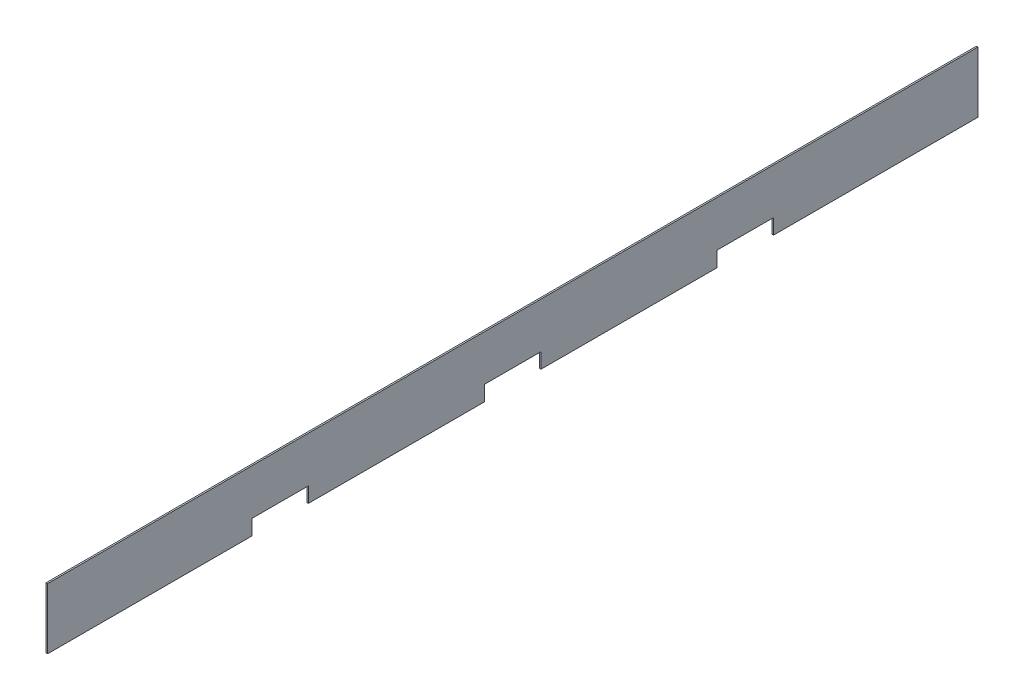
SolidWorks part; units mm, degrees
ref_plane "Vorne" through (0, 0, 0) normal (0, 0, 1) x (1, 0, 0)
ref_plane "Oben" through (0, 0, 0) normal (0, 1, 0) x (1, 0, 0)
ref_plane "Rechts" through (0, 0, 0) normal (1, 0, 0) x (0, 0, -1)
sketch "Skizze1" plane through (0, 0, 0) normal (0, 1, 0) x (1, 0, 0)
  circle A0 centre (0, 0) radius 96.8883
extrude "Linear-Austragen-Dünn1" add sketch "Skizze1" along normal blind 40 thin
sketch "Skizze2" plane through (0, 0, 0) normal (0, 1, 0) x (1, 0, 0)
  line L1 (-18.3447, 95.1358) -> (18.3447, 95.1358)
  line L2 (-18.3447, 95.1358) -> (-18.3447, 97.8883)
  line L3 (-18.3447, 97.8883) -> (18.3447, 97.8883)
  line L4 (18.3447, 95.1358) -> (18.3447, 97.8883)
  circle A0 centre (0, 0) radius 96.8883 construction
  circle A1 centre (0, 0) radius 97.8883 construction
extrude "Schnitt-Linear austragen1" cut sketch "Skizze2" along normal blind 10
pattern_circular "Kreismuster1" count 4 over 360 about axis through (0, 40, 0) along (0, -1, 0) of "Schnitt-Linear austragen1"
sketch "Skizze4" plane through (0, 0, 0) normal (0, 1, 0) x (1, 0, 0)
  line L0 (0, 0) -> (97.8883, 0.05)
  line L1 (97.8883, 0.05) -> (97.8883, -0.05)
  line L2 (97.8883, -0.05) -> (0, 0)
  line L3 (0, 0) -> (97.8883, 0) construction
  circle A0 centre (0, 0) radius 97.8883 construction
  dimension "D1" = 0.1
extrude "Schnitt-Linear austragen2" cut sketch "Skizze4" along normal through all
sheet metal parameters "Blech1" parameters "D1"=2
bend "Biegung-Rundung1" bend radius 96.8883 bend angle 359.941 parameters "D5"=1
flatten bends "Abwickeln1" parameters "D1"=0
sketch "Skizze-Winkel1" plane through (96.8883, 20, 0.0495) normal (-1, 0, -0.0005) x (-0.0005, 0, 1)
  line L0 (305.9047, -20) -> (305.9047, 20) construction
